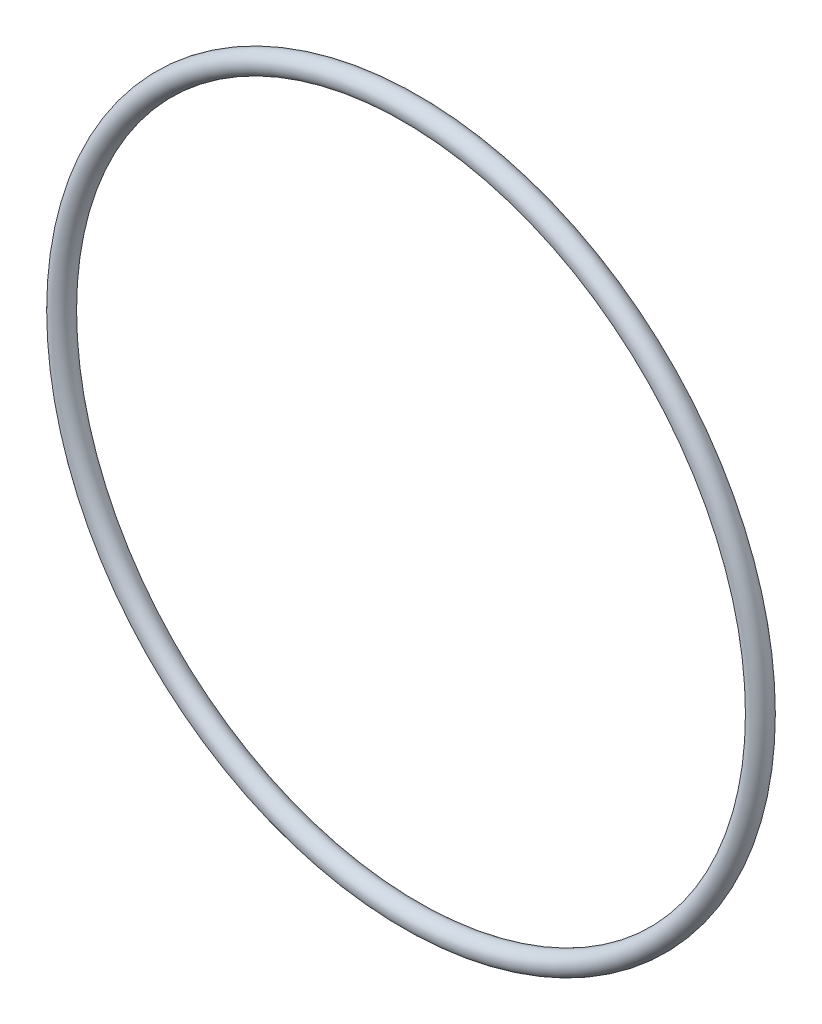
SolidWorks part; units mm, degrees
ref_plane "FRONT" through (0, 0, 0) normal (0, 0, 1) x (1, 0, 0)
ref_plane "TOP" through (0, 0, 0) normal (0, 1, 0) x (1, 0, 0)
ref_plane "RIGHT SIDE" through (0, 0, 0) normal (1, 0, 0) x (0, 0, -1)
sketch "Sketch1" plane through (0, 0, 0) normal (1, 0, 0) x (0, 0, -1)
  line L0 (-58.42, 0) -> (55.88, 0) construction
  line L1 (0, 50.8) -> (0, -40.64) construction
  circle A0 centre (0, 29.337) radius 0.889
  dimension "D1" = 1.778
  dimension "D2" = 29.337
revolve "Base-Revolve" add sketch "Sketch1" angle 360 about L0
